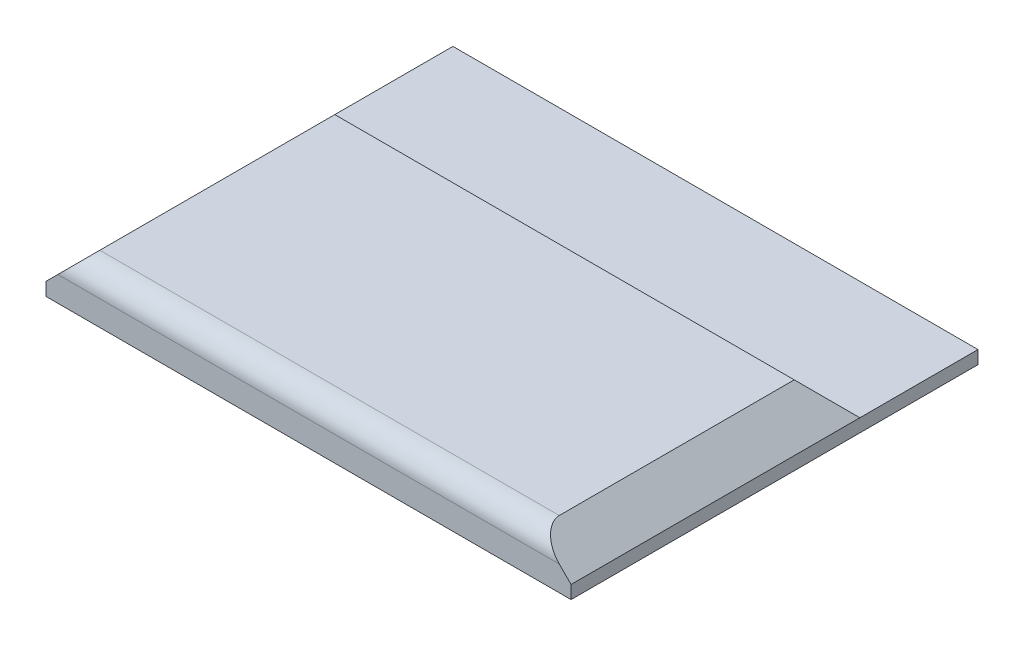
SolidWorks part; units mm, degrees
ref_plane "Front" through (0, 0, 0) normal (0, 0, 1) x (1, 0, 0)
ref_plane "Top" through (0, 0, 0) normal (0, 1, 0) x (1, 0, 0)
ref_plane "Right" through (0, 0, 0) normal (1, 0, 0) x (0, 0, -1)
sketch "Sketch2" plane through (0, 0, 0) normal (0, 1, 0) x (1, 0, 0)
  line L1 (0, 0) -> (63.5, 0)
  line L2 (0, 0) -> (0, 49.2125)
  line L3 (0, 49.2125) -> (63.5, 49.2125)
  line L4 (63.5, 0) -> (63.5, 49.2125)
  dimension "D1" = 49.2125
  dimension "D2" = 63.5
extrude "Extrude1" add sketch "Sketch2" along normal blind 1.5875
sketch "Sketch3" plane through (0, 1.5875, 0) normal (0, 1, 0) x (-1, 0, 0)
  line L0 (0, -49.2125) -> (0, 0) construction
  line L1 (-63.5, 0) -> (0, 0)
  line L2 (-63.5, 0) -> (-63.5, -34.925)
  line L3 (-63.5, -34.925) -> (0, -34.925)
  line L4 (0, 0) -> (0, -34.925)
  dimension "D1" = 34.925
extrude "Extrude2" add sketch "Sketch3" along normal blind 3.9688
chamfer "Chamfer2" distance 3.9688 angle 45 3 edges at (63.5, 5.5563, -17.4625) (31.75, 5.5563, -34.925) (0, 5.5563, -17.4625)
shell "Shell1" thickness 1.5875
fillet "Fillet1" [suppressed] radius 1.905
fillet "Fillet4" radius 2.54 1 edges at (31.75, 5.5562, 0)
fillet "Fillet12" [suppressed] radius 0.3175
sketch "Sketch8" [suppressed] plane through (0, 0, 0) normal (1, 0, 0) x (0, 0, -1)
  line L0 (49.2125, 0) -> (75.7074, -3.5069) construction
  line L1 (49.2125, 0) -> (1.905, 0) construction
  line L2 (49.2125, 0) -> (1.905, 0) construction
  line L3 (49.2125, 0) -> (46.4385, -20.9579) construction
  line L4 (49.2125, 0) -> (52.3875, 0) construction
  line L5 (52.3875, 0) -> (52.3875, 17.1152) construction
  line L6 (47.9626, -9.4426) -> (62.7303, -11.3973) construction
  line L7 (47.9626, -9.4426) -> (49.2125, 0)
  line L9 (47.9626, -9.4426) -> (51.1102, -9.8593)
  line L10 (49.7447, -8.0772) -> (50.7596, -0.41)
  line L11 (49.2125, 1.5875) -> (50.7596, -0.41)
  line L12 (49.2125, 1.5875) -> (49.2125, 0)
  line L14 (51.1102, -9.8593) -> (51.3185, -8.2855)
  line L15 (49.7447, -8.0772) -> (51.3185, -8.2855)
  dimension "D1" = 172.46
  dimension "D2" = 3.175
  dimension "D3" = 9.525
  dimension "D4" = 1.5875
  dimension "D6" = 1.5875
  dimension "D7" = 3.175
extrude "Extrude8" [suppressed] add sketch "Sketch8" along normal up to vertex
sketch "Sketch4" plane through (0, 5.5563, 0) normal (0, 1, 0) x (-1, 0, 0)
  line L0 (-4.1003, -16.6824) -> (-59.3997, -16.6824) construction
  line L2 (-4.894, -17.0792) -> (-58.606, -17.0792)
  line L3 (-4.894, -17.0792) -> (-4.894, -16.2855)
  line L12 (-4.894, -16.2855) -> (-58.606, -16.2855)
  line L13 (-58.606, -17.0792) -> (-58.606, -16.2855)
  point P11 (-58.606, -16.6824)
  dimension "D4" = 0.7937
extrude "Extrude6" [suppressed] add sketch "Sketch4" along normal blind 0.7937
fillet "Fillet13" [suppressed] radius 0.3175
pattern_linear "LPattern3" [suppressed] count 9 spacing 1.5875
pattern_linear "LPattern4" [suppressed] count 9 spacing 1.5875
ref_plane "Plane1" through (0, 0, -14.2875) normal (0, 0, -1) x (-1, 0, 0)
sketch "Sketch6" plane through (0, 0, 0) normal (0, -1, 0) x (1, 0, 0)
  line L0 (61.9125, -1.5875) -> (61.9125, -34.2674) construction
  line L1 (1.5875, -34.2674) -> (1.5875, -1.5875) construction
  line L2 (61.9125, -34.2674) -> (1.5875, -34.2674) construction
  line L3 (1.5875, -1.5875) -> (61.9125, -1.5875) construction
  line L4 (61.9125, -1.5875) -> (61.9125, -34.2674) construction
  line L5 (1.5875, -34.2674) -> (1.5875, -1.5875) construction
  line L6 (61.9125, -34.2674) -> (1.5875, -34.2674) construction
  line L7 (1.5875, -1.5875) -> (61.9125, -1.5875) construction
  line L8 (15.875, -1.5875) -> (15.875, -34.2674)
  line L9 (47.625, -1.5875) -> (47.625, -34.2674)
  line L10 (1.5875, -11.1125) -> (61.9125, -11.1125)
  line L11 (1.5875, -23.8125) -> (61.9125, -23.8125)
  dimension "D1" = 14.2875
  dimension "D2" = 14.2875
  dimension "D3" = 9.525
  dimension "D4" = 12.7
rib "Rib8" sketch "Sketch6" sketch "Sketch6" thickness 0.7937 extrusion direction normal to sketch draft on no parameters "D1"=0.7937
fillet "Fillet16" [suppressed] radius 0.3175
chamfer "Chamfer3" [suppressed] distance 0.7937 angle 45
fillet "Fillet17" [suppressed] radius 0.3175
sketch "Sketch7" plane through (0, 3.9688, 0) normal (0, -1, 0) x (1, 0, 0)
  line L0 (16.2719, -17.4625) -> (47.2281, -17.4625) construction
  line L1 (31.75, -11.5094) -> (31.75, -23.4156) construction
  line L2 (30.9563, -18.2563) -> (30.9563, -20.6375)
  line L3 (30.9563, -14.2875) -> (32.5438, -14.2875)
  line L4 (16.2719, -11.5094) -> (16.2719, -23.4156)
  line L5 (16.2719, -23.4156) -> (47.2281, -23.4156)
  line L6 (47.2281, -23.4156) -> (47.2281, -11.5094)
  line L7 (47.2281, -11.5094) -> (16.2719, -11.5094)
  line L8 (16.2719, -11.5094) -> (16.2719, -23.4156) construction
  line L9 (16.2719, -23.4156) -> (47.2281, -23.4156) construction
  line L10 (47.2281, -23.4156) -> (47.2281, -11.5094) construction
  line L11 (47.2281, -11.5094) -> (16.2719, -11.5094) construction
  line L12 (30.9563, -14.2875) -> (30.9563, -16.6688)
  line L13 (30.9563, -20.6375) -> (32.5438, -20.6375)
  line L14 (32.5438, -14.2875) -> (32.5438, -16.6688)
  line L15 (28.575, -16.6688) -> (30.9563, -16.6688)
  line L16 (28.575, -16.6688) -> (28.575, -18.2563)
  line L17 (28.575, -18.2563) -> (30.9563, -18.2563)
  line L18 (34.925, -16.6688) -> (34.925, -18.2563)
  line L19 (32.5438, -16.6688) -> (34.925, -16.6688)
  line L20 (32.5438, -18.2563) -> (32.5438, -20.6375)
  line L21 (32.5438, -18.2563) -> (34.925, -18.2563)
  circle A0 centre (31.75, -17.4625) radius 5.08 construction
  point P16 (28.575, -17.4625)
  point P17 (31.75, -20.6375)
  dimension "D2" = 1.5875
  dimension "D3" = 1.5875
  dimension "D4" = 3.175
  dimension "D5" = 3.175
  dimension "D6" = 3.175
  dimension "D7" = 3.175
  dimension "D1" = 0
ref_plane "Plane2" through (31.75, 0, 0) normal (1, 0, 0) x (0, 0, -1)
sketch "Sketch9" [suppressed] plane through (31.75, 0, 0) normal (1, 0, 0) x (0, 0, -1)
  line L0 (49.2125, 0) -> (46.4385, -20.9579) construction
  line L1 (49.2125, 0) -> (46.4385, -20.9579) construction
  line L2 (11.5094, 3.9688) -> (23.4156, 3.9688) construction
  line L3 (11.5094, 3.9688) -> (23.4156, 3.9688) construction
  line L4 (17.4625, 3.9688) -> (16.6293, -2.3263)
  dimension "D1" = 6.35
sweep "Sweep1" [suppressed] add profiles "Sketch7" path "Sketch9"
fillet "Fillet18" [suppressed] radius 0.3175
